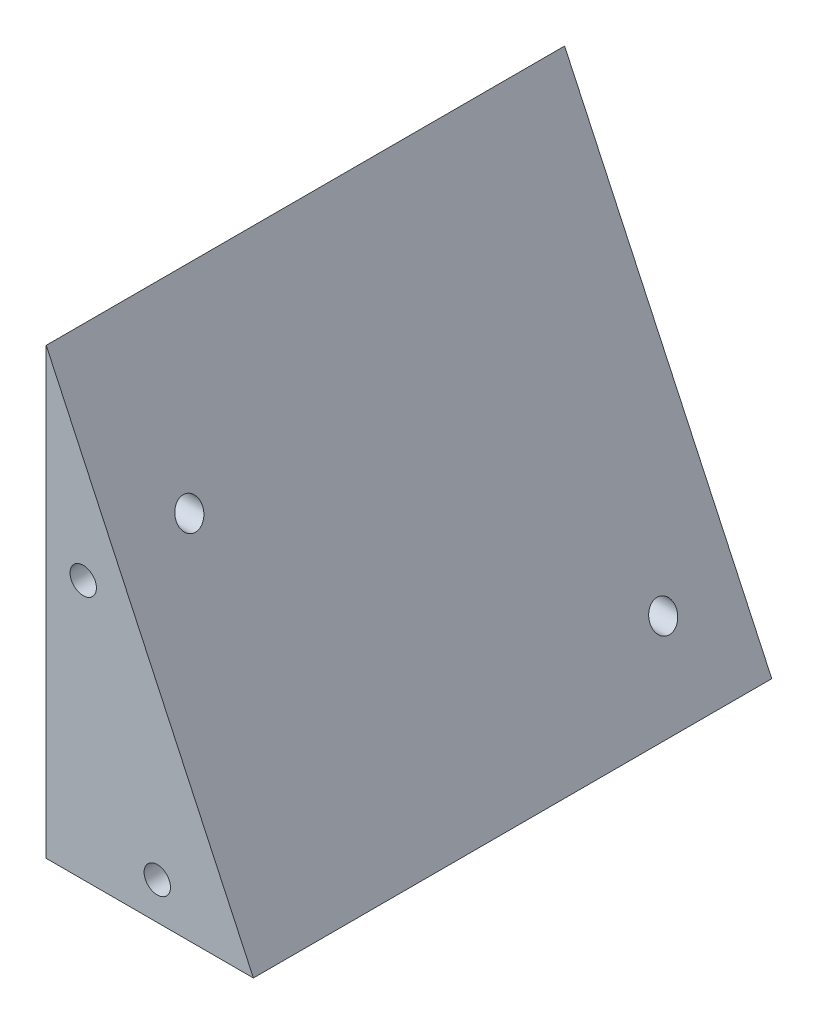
SolidWorks part; units mm, degrees
ref_plane "Front Plane" through (0, 0, 0) normal (0, 0, 1) x (1, 0, 0)
ref_plane "Top Plane" through (0, 0, 0) normal (0, 1, 0) x (1, 0, 0)
ref_plane "Right Plane" through (0, 0, 0) normal (1, 0, 0) x (0, 0, -1)
sketch "Sketch1" plane through (0, 0, 0) normal (0, 0, 1) x (1, 0, 0)
  line L0 (0, 0) -> (0, 38.1)
  line L1 (0, 38.1) -> (17.7663, 0)
  line L2 (17.7663, 0) -> (0, 0)
  dimension "D1" = 38.1
  dimension "D2" = 25
extrude "Extrude1" add sketch "Sketch1" along normal blind 44.45
hole_wizard "#4-40 Tapped Hole1" positions "3DSketch1" profile "Sketch3" tap size "#4-40" standard "Ansi Inch"
sketch3d "3DSketch1"
  line L0 (0, 25.4, 38.1) -> (0, 25.4, 44.45) construction
  line L1 (0, 38.1, 44.45) -> (0, 0, 44.45) construction
  line L4 (0, 6.35, 6.35) -> (0, 6.35, 0) construction
  line L5 (0, 38.1, 0) -> (0, 0, 0) construction
  line L8 (0, 0, 44.45) -> (0, 0, 0) construction
  line L9 (0, 6.35, 6.35) -> (0, 15.4674, 6.35) construction
  point P0 (0, 6.35, 6.35)
  point P2 (0, 25.4, 38.1)
  dimension "D1" = 19.05
  dimension "D2" = 6.35
  dimension "D3" = 31.75
sketch "Sketch3" plane through (0, 6.35, 6.35) normal (0, 1, 0) x (0, 0, 1)
  line L0 (0, 0) -> (0, 17.7663)
  line L1 (0, 17.7663) -> (1.1303, 17.7663)
  line L2 (1.1303, 17.7663) -> (1.1303, 0)
  line L5 (1.1303, 0) -> (0, 0)
  line L11 (0, -6.35) -> (0, 107.95) construction
  dimension "Thru Tap Drill Dia." = 2.2606
  dimension "Thru Tap Drill Depth" = 17.7663
hole_wizard "#4-40 Tapped Hole2" positions "3DSketch2" profile "Sketch4" tap size "#4-40" standard "Ansi Inch"
sketch3d "3DSketch2"
  line L0 (0, 0, 44.45) -> (17.7663, 0, 44.45) construction
  line L4 (9.525, 3.175, 44.45) -> (2.6334, 3.175, 44.45) construction
  line L7 (3.175, 22.225, 44.45) -> (6.6478, 22.225, 44.45) construction
  line L10 (0, 38.1, 44.45) -> (0, 0, 44.45) construction
  point P0 (3.175, 22.225, 44.45)
  point P2 (9.525, 3.175, 44.45)
  dimension "D1" = 3.175
  dimension "D2" = 19.05
  dimension "D3" = 3.175
  dimension "D4" = 9.525
sketch "Sketch4" plane through (3.175, 22.225, 44.45) normal (1, 0, 0) x (0, -1, 0)
  line L0 (0, 0) -> (0, 13.3792)
  line L1 (0, 13.3792) -> (1.1303, 12.7)
  line L2 (1.1303, 12.7) -> (1.1303, 0)
  line L5 (1.1303, 0) -> (0, 0)
  line L10 (0, 13.3792) -> (-1.1303, 12.7) construction
  line L11 (0, -6.35) -> (0, 107.95) construction
  dimension "Tap Drill Dia." = 2.2606
  dimension "Tap Drill Depth" = 12.7
  dimension "Drill Angle" = 118
